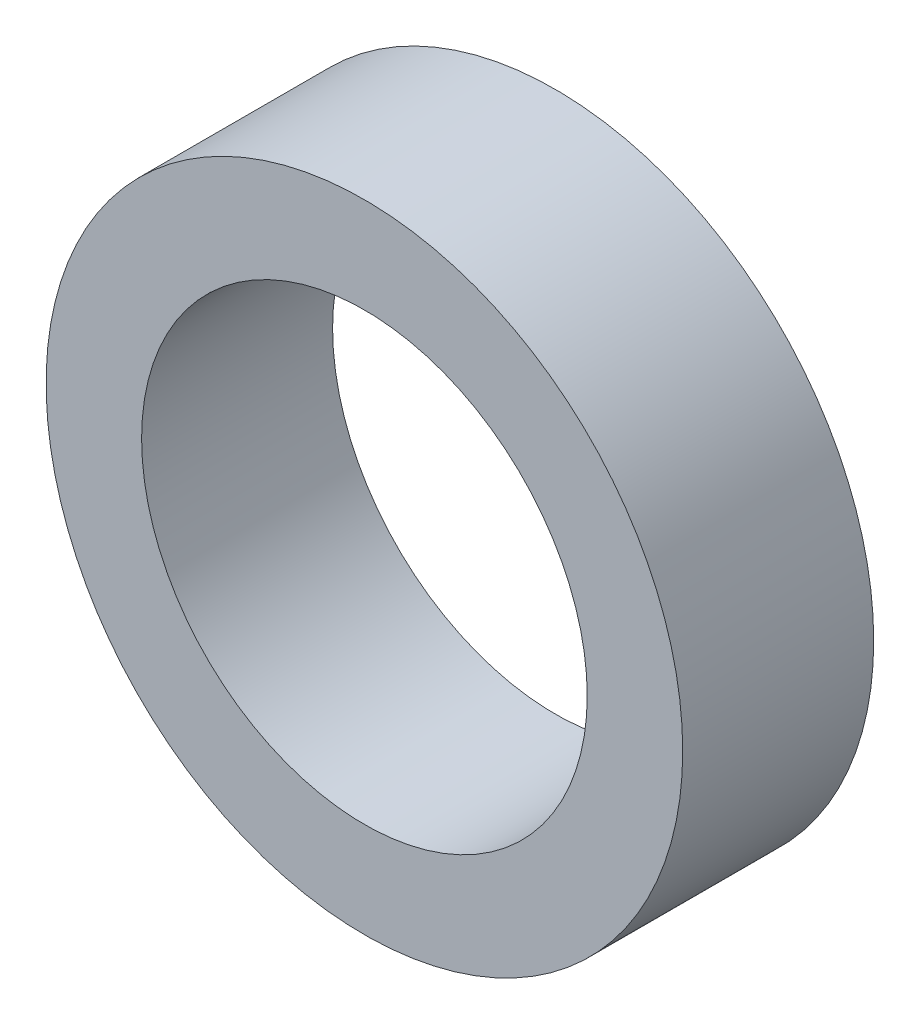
SolidWorks part; units mm, degrees
ref_plane "Face" through (0, 0, 0) normal (0, 0, 1) x (1, 0, 0)
ref_plane "Dessus" through (0, 0, 0) normal (0, 1, 0) x (1, 0, 0)
ref_plane "Profil" through (0, 0, 0) normal (1, 0, 0) x (0, 0, -1)
sketch "Esquisse1" plane through (0, 0, 0) normal (0, 0, 1) x (1, 0, 0)
  circle A0 centre (0, 0) radius 3
  circle A1 centre (0, 0) radius 2.1
  dimension "D1" = 4.2
  dimension "D2" = 6
extrude "Extrusion1" add sketch "Esquisse1" along normal blind 1.8
